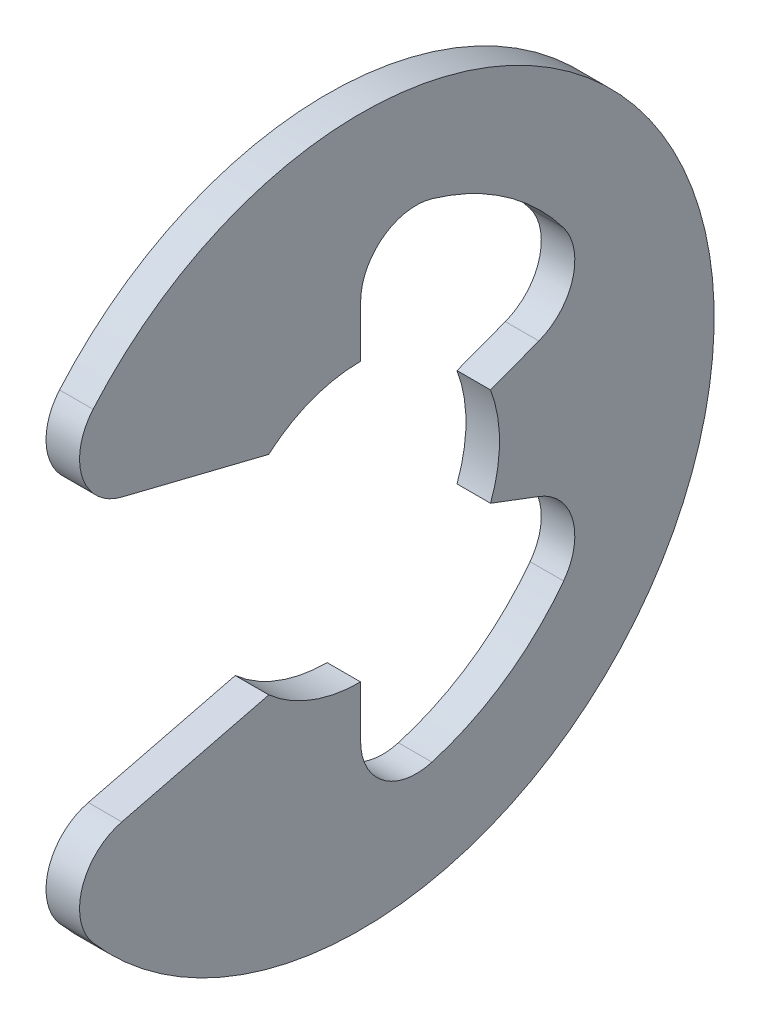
SolidWorks part; units mm, degrees
ref_plane "Front" through (0, 0, 0) normal (0, 0, 1) x (1, 0, 0)
ref_plane "Top" through (0, 0, 0) normal (0, 1, 0) x (1, 0, 0)
ref_plane "Right" through (0, 0, 0) normal (1, 0, 0) x (0, 0, -1)
sketch "Sketch1" plane through (0, 0, 0) normal (1, 0, 0) x (0, 0, -1)
  line L0 (-5.9715, -3.0225) -> (-1.7389, -1.9717)
  line L1 (-5.9715, 3.0225) -> (-1.7389, 1.9717)
  line L2 (0, -2.6289) -> (0, -4.8113)
  line L3 (0, 2.6289) -> (0, 4.8113)
  line L4 (2.4591, -0.9295) -> (4.5005, -1.701)
  line L5 (2.4591, 0.9295) -> (4.5005, 1.701)
  line L6 (0, 0) -> (-6.858, 0) construction
  line L7 (2.4591, 0.9295) -> (2.4591, -0.9295) construction
  line L8 (0, -2.6289) -> (-1.7389, -1.9717) construction
  circle A1 centre (0, 0) radius 6.858 construction
  circle A2 centre (0, 0) radius 2.6289 construction
  arc A3 (-5.9715, -3.0225) -> (-5.9715, 3.0225) centre (0, 0) ccw
  arc A4 (-1.7389, -1.9717) -> (0, -2.6289) centre (0, 0) ccw
  arc A5 (-1.7389, 1.9717) -> (0, 2.6289) centre (0, 0) cw
  arc A6 (2.4591, 0.9295) -> (2.4591, -0.9295) centre (0, 0) cw
  arc A7 (0, -4.8113) -> (4.5005, -1.701) centre (0, 0) ccw
  arc A8 (4.5005, 1.701) -> (0, 4.8113) centre (0, 0) ccw
  dimension "D1" = 4.8113
  dimension "OD" = 13.3858
  dimension "L" = 13.716
  dimension "D" = 5.2578
  dimension "D2" = 2.9892
  dimension "D3" = 3.9434
extrude "Extrude1" add sketch "Sketch1" along normal mid plane 0.635
fillet "Fillet1" radius 1.0541 6 edges at (0, -4.8113, 0) (0, 4.8113, 0) (0, -3.0225, 5.9715) (0, 3.0225, 5.9715) (0, -1.701, -4.5005) (0, 1.701, -4.5005)
sketch "Sketch3" plane through (0, 0, 0) normal (0, 1, 0) x (1, 0, 0)
  line L0 (0.3683, 3.175) -> (0.3683, 2.667)
  line L1 (0.3683, 2.667) -> (-0.3683, 2.667)
  line L2 (-0.3683, 2.667) -> (-0.3683, 3.175)
  line L3 (-0.3683, 3.175) -> (-7.9184, 3.175)
  line L4 (3.1306, 0) -> (3.1306, 2.921)
  line L5 (-7.9184, 3.175) -> (-7.9184, 0)
  line L6 (-7.9184, 0) -> (3.1306, 0)
  line L8 (3.1306, 0) -> (3.1306, 3.175) construction
  line L9 (3.1306, 3.175) -> (0.3683, 3.175) construction
  line L10 (3.1306, 0) -> (17.2631, 0) construction
  line L11 (3.1306, 2.921) -> (2.8765, 3.175)
  line L12 (2.8765, 3.175) -> (0.3683, 3.175)
  point P2 (0, 2.667)
  point P5 (0.3683, 2.921)
  dimension "D1" = 2.7622
  dimension "Ds" = 6.35
  dimension "Dg" = 5.334
  dimension "W" = 0.7366
  dimension "D2" = 11.049
  dimension "D3" = 45
revolve "Revolve2" add sketch "Sketch3" angle 360 about L10
equation "\"D2@Sketch3\" = \"W@Sketch3\"*15"
equation "\"D1@Sketch3\" = \"D2@Sketch3\"/4"
equation "\"D1@Sketch1\" = (\"OD@Sketch1\"+\"D@Sketch1\")/3.875"
equation "\"D3@Sketch1\" = \"D@Sketch1\"*.75"
